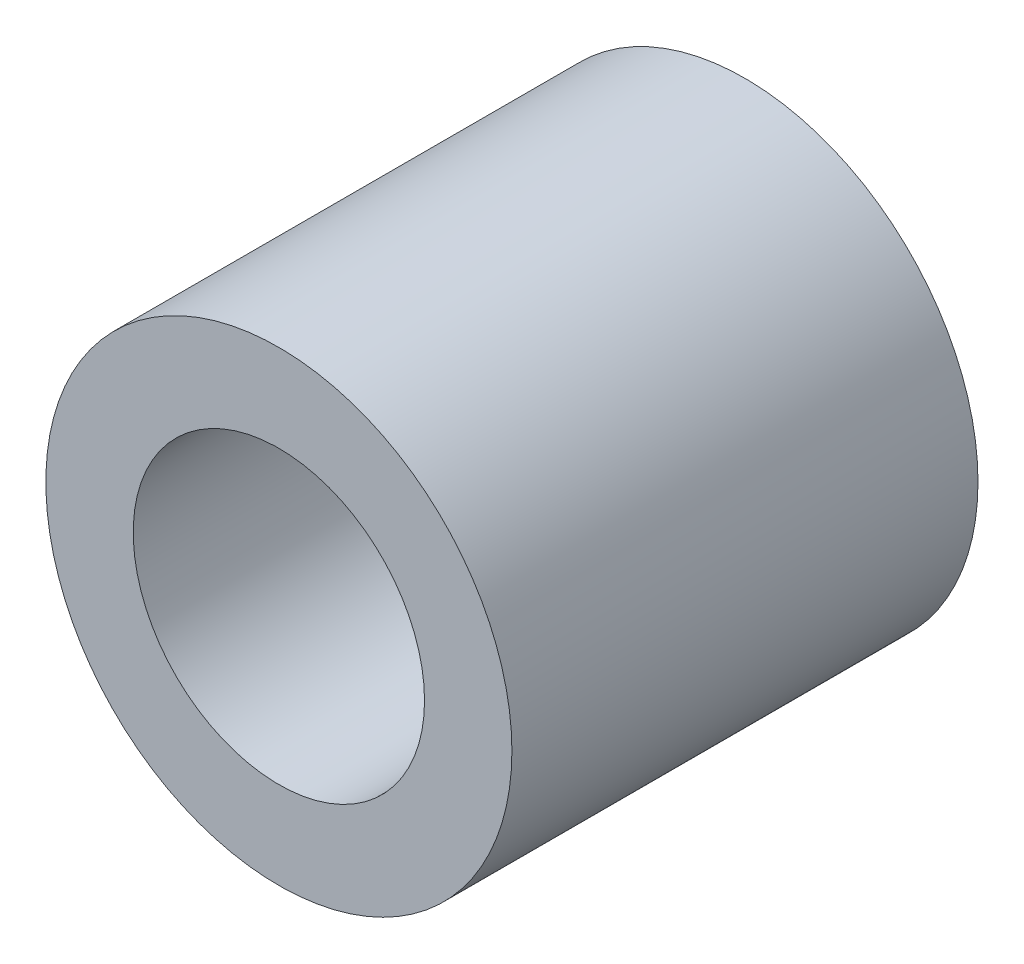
SolidWorks part; units mm, degrees
ref_plane "Ön Düzlem" through (0, 0, 0) normal (0, 0, 1) x (1, 0, 0)
ref_plane "Üst Düzlem" through (0, 0, 0) normal (0, 1, 0) x (1, 0, 0)
ref_plane "Sağ Düzlem" through (0, 0, 0) normal (1, 0, 0) x (0, 0, -1)
sketch "Çizim1" plane through (0, 0, 0) normal (0, 0, 1) x (1, 0, 0)
  circle A0 centre (0, 0) radius 0.8
  circle A1 centre (0, 0) radius 0.5
  dimension "D1" = 1.6
  dimension "D2" = 1
extrude "Yükseklik-Ekstrüzyon1" add sketch "Çizim1" along normal blind 1.6
